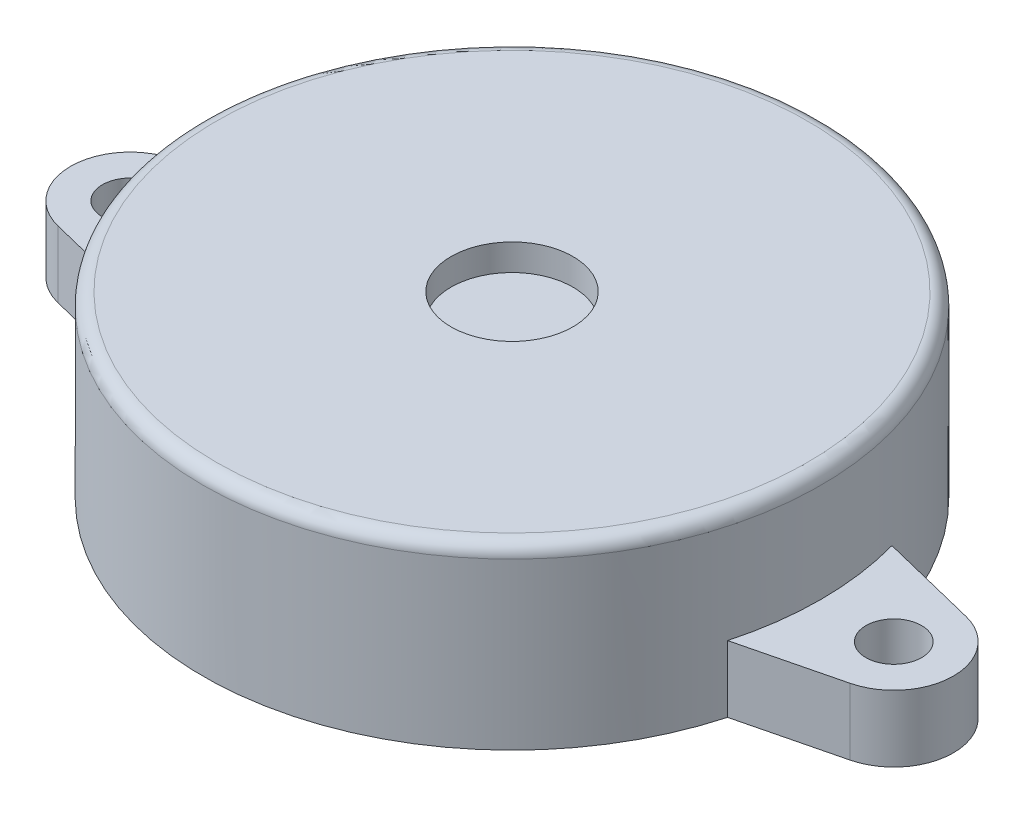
SolidWorks part; units mm, degrees
ref_plane "Plan de face" through (0, 0, 0) normal (0, 0, 1) x (1, 0, 0)
ref_plane "Plan de dessus" through (0, 0, 0) normal (0, 1, 0) x (1, 0, 0)
ref_plane "Plan de droite" through (0, 0, 0) normal (1, 0, 0) x (0, 0, -1)
sketch "Esquisse1" plane through (0, 0, 0) normal (0, 1, 0) x (1, 0, 0)
  circle A0 centre (0, 0) radius 11.65
extrude "Boss.-Extru.1" add sketch "Esquisse1" along normal blind 4.23
sketch "Esquisse2" plane through (0, 0, 0) normal (0, -1, 0) x (1, 0, 0)
  line L0 (18.4607, 0) -> (-11.2654, 0) construction
  line L1 (0, -1.8598) -> (0, 8.5062) construction
  line L2 (14.4, 9.177) -> (14.4, -1.8598) construction
  line L3 (18.4607, 3.1) -> (11.23, 3.1) construction
  line L4 (11.23, 3.1) -> (14.9392, 2.1844)
  line L5 (11.23, -3.1) -> (14.9392, -2.1844)
  line L6 (-11.23, -3.1) -> (-14.9392, -2.1844)
  line L7 (-11.23, 3.1) -> (-14.9392, 2.1844)
  arc A0 (11.23, 3.1) -> (-11.23, 3.1) centre (0, 0) ccw
  circle A1 centre (14.4, 0) radius 1.05
  circle A2 centre (-14.4, 0) radius 1.05
  circle A3 centre (0, 0) radius 11.65 construction
  arc A4 (14.9392, -2.1844) -> (14.9392, 2.1844) centre (14.4, 0) ccw
  arc A5 (-14.9392, -2.1844) -> (-14.9392, 2.1844) centre (-14.4, 0) cw
  arc A6 (-11.23, -3.1) -> (11.23, -3.1) centre (0, 0) ccw
  dimension "D2" = 3.1
  dimension "D1" = 14.4
extrude "Boss.-Extru.2" add sketch "Esquisse2" along normal blind 2.51
sketch "Esquisse3" plane through (0, 4.23, 0) normal (0, 1, 0) x (1, 0, 0)
  circle A0 centre (0, 0) radius 2.3
extrude "Enlèv. mat.-Extru.1" cut sketch "Esquisse3" against normal blind 1
fillet "Congé1" radius 0.5 1 edges at (0, 4.23, 11.65)
